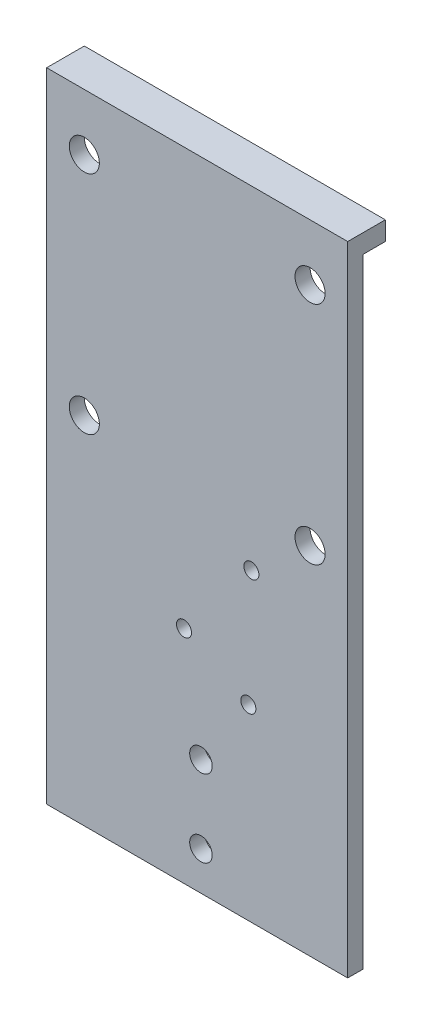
SolidWorks part; units mm, degrees
ref_plane "Plan de face" through (0, 0, 0) normal (0, 0, 1) x (1, 0, 0)
ref_plane "Plan de dessus" through (0, 0, 0) normal (0, 1, 0) x (1, 0, 0)
ref_plane "Plan de droite" through (0, 0, 0) normal (1, 0, 0) x (0, 0, -1)
sketch "Esquisse1" plane through (0, 0, 0) normal (0, 0, 1) x (1, 0, 0)
  line L1 (-29.009, 50.9055) -> (50.991, 50.9055)
  line L2 (-29.009, 50.9055) -> (-29.009, -118.5945)
  line L3 (-29.009, -118.5945) -> (50.991, -118.5945)
  line L4 (50.991, 50.9055) -> (50.991, -118.5945)
  dimension "D1" = 80
  dimension "D2" = 169.5
extrude "Boss.-Extru.1" add sketch "Esquisse1" along normal blind 4
sketch "Esquisse2" plane through (0, 0, 4) normal (0, 0, 1) x (1, 0, 0)
  line L0 (-19.009, 50.9055) -> (-19.009, -29.0945) construction
  line L1 (50.991, 50.9055) -> (-29.009, 50.9055) construction
  line L2 (40.991, 50.9055) -> (40.991, -29.0945) construction
  line L3 (-29.009, 35.9055) -> (50.991, 35.9055) construction
  line L4 (-29.009, 50.9055) -> (-29.009, -118.5945) construction
  line L5 (50.991, -118.5945) -> (50.991, 50.9055) construction
  line L6 (-29.009, -24.0945) -> (50.991, -24.0945) construction
  circle A0 centre (-19.009, 35.9055) radius 4
  circle A1 centre (40.991, 35.9055) radius 4
  circle A2 centre (-19.009, -24.0945) radius 4
  circle A3 centre (40.991, -24.0945) radius 4
  dimension "D6" = 8
  dimension "D7" = 8
  dimension "D8" = 8
  dimension "D9" = 8
  dimension "D1" = 80
  dimension "D2" = 15
  dimension "D3" = 60
  dimension "D4" = 10
  dimension "D5" = 10
extrude "Enlèv. mat.-Extru.1" cut sketch "Esquisse2" against normal through all
sketch "Esquisse5" plane through (0, 0, 4) normal (0, 0, 1) x (1, 0, 0)
  line L0 (10.991, -118.5945) -> (10.991, -35.3846) construction
  line L1 (-29.009, -118.5945) -> (50.991, -118.5945) construction
  line L2 (4.991, -118.5945) -> (4.991, -73.4707) construction
  line L3 (18.991, -73.4707) -> (18.991, -118.5945) construction
  line L4 (18.991, -118.5945) -> (18.991, -113.9278) construction
  line L5 (11.991, -73.4707) -> (11.991, -118.5945) construction
  circle A0 centre (11.991, -108.3445) radius 3
  circle A1 centre (11.991, -87.8445) radius 3
  dimension "D4" = 6
  dimension "D5" = 6
  dimension "D1" = 6
  dimension "D2" = 14
  dimension "D3" = 7
  dimension "D6" = 20.5
  dimension "D7" = 10.25
extrude "Enlèv. mat.-Extru.2" cut sketch "Esquisse5" against normal through all
sketch "Esquisse6" plane through (0, 0, 0) normal (0, 0, -1) x (-1, 0, 0)
  line L0 (29.009, 50.9055) -> (29.009, -118.5945) construction
  line L1 (-50.991, 50.9055) -> (29.009, 50.9055)
  line L2 (-50.991, 50.9055) -> (-50.991, 45.9055)
  line L3 (-50.991, 45.9055) -> (29.009, 45.9055)
  line L4 (29.009, 50.9055) -> (29.009, 45.9055)
  dimension "D1" = 5
extrude "Boss.-Extru.2" add sketch "Esquisse6" along normal blind 6
sketch "Esquisse7" plane through (0, 0, 4) normal (0, 0, 1) x (1, 0, 0)
  line L0 (-29.009, -118.5945) -> (50.991, -118.5945) construction
  line L5 (-29.009, 50.9055) -> (-29.009, -118.5945) construction
  line L6 (50.991, -118.5945) -> (50.991, 50.9055) construction
  line L7 (50.991, 50.9055) -> (-29.009, 50.9055) construction
  circle A0 centre (7.491, -59.8945) radius 2
  circle A1 centre (25.391, -37.5945) radius 2
  circle A2 centre (24.591, -68.8745) radius 2
  dimension "D5" = 4
  dimension "D6" = 4
  dimension "D7" = 4
  dimension "D9" = 58.7
  dimension "D10" = 26.4
  dimension "D11" = 49.72
  dimension "D12" = 88.5
  dimension "D13" = 25.6
  dimension "D8" = 36.5
extrude "Enlèv. mat.-Extru.5" cut sketch "Esquisse7" against normal through all
